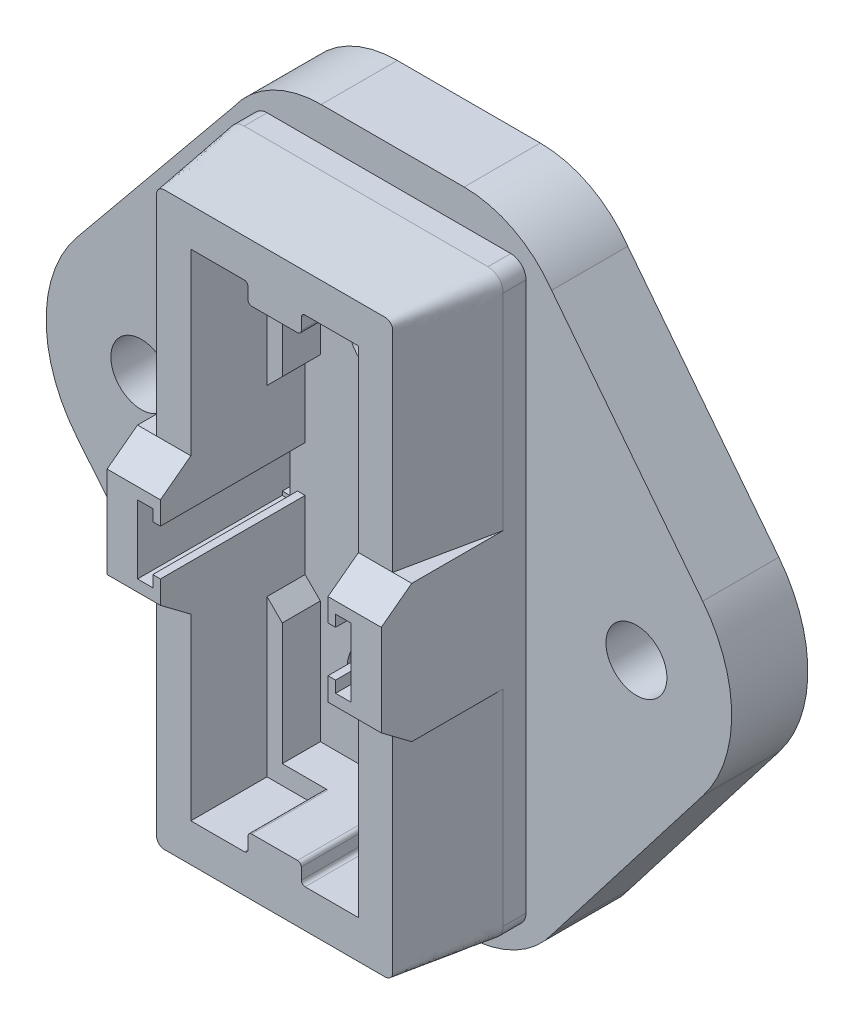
SolidWorks part; units mm, degrees
ref_plane "Plan de face" through (0, 0, 0) normal (0, 0, 1) x (1, 0, 0)
ref_plane "Plan de dessus" through (0, 0, 0) normal (0, 1, 0) x (1, 0, 0)
ref_plane "Plan de droite" through (0, 0, 0) normal (1, 0, 0) x (0, 0, -1)
sketch "Esquisse1" plane through (0, 0, 0) normal (0, 0, 1) x (1, 0, 0)
  line L0 (-68.9124, 0) -> (68.9124, 0) construction
  line L1 (0, 58.4711) -> (0, -58.4711) construction
  line L2 (-8.8895, 42.5) -> (9.8722, 42.5)
  line L3 (21.5728, -36.5) -> (41.2511, -10.9957)
  line L4 (21.3614, 36.5) -> (41.1939, 11.0694)
  line L5 (10.0836, -42.5) -> (-8.8895, -42.5)
  line L6 (-20.3787, -36.5) -> (-40.9272, -11.4032)
  line L7 (-20.3787, 36.5) -> (-40.9272, 11.4032)
  line L8 (45, 0) -> (45, 40.5367) construction
  line L9 (-45, 0) -> (-45, 38.6875) construction
  arc A0 (21.3614, 36.5) -> (9.8722, 42.5) centre (9.8722, 28.5) ccw
  arc A1 (-20.3787, 36.5) -> (-8.8895, 42.5) centre (-8.8895, 28.5) cw
  arc A2 (-8.8895, -42.5) -> (-20.3787, -36.5) centre (-8.8895, -28.5) cw
  arc A3 (21.5728, -36.5) -> (10.0836, -42.5) centre (10.0836, -28.5) cw
  arc A4 (41.2511, -10.9957) -> (41.1939, 11.0694) centre (27, 0) ccw
  arc A5 (-40.9272, 11.4032) -> (-40.9272, -11.4032) centre (-27, 0) ccw
  point P11 (17.4253, 44.5086)
  point P14 (-16.4426, 44.5086)
  point P17 (-16.4426, -45.4914)
  point P20 (17.4253, -45.4914)
  dimension "D2" = 14
  dimension "D3" = 36
  dimension "D4" = 36
  dimension "D1" = 85
  dimension "D5" = 90
  dimension "D8" = 6
  dimension "D9" = 6
extrude "Extrusion1" add sketch "Esquisse1" along normal blind 10
sketch "Esquisse2" plane through (0, 0, 0) normal (0, 0, -1) x (-1, 0, 0)
  line L0 (-59.0836, 0) -> (59.0836, 0) construction
  line L1 (32.5, 38.0939) -> (32.5, 6.9041) construction
  line L2 (-32.5, 38.0939) -> (-32.5, 8.0295) construction
  line L3 (0, 40.9877) -> (0, -9.4946) construction
  circle A0 centre (-32.5, 0) radius 4
  circle A1 centre (32.5, 0) radius 4
  dimension "D3" = 8
  dimension "D4" = 8
  dimension "D1" = 65
  dimension "D2" = 32.5
extrude "Enlèv. mat.-Extru.1" cut sketch "Esquisse2" against normal through all
sketch "Esquisse3" plane through (0, 0, 10) normal (0, 0, 1) x (1, 0, 0)
  line L0 (0, 0) -> (0, 49.1871) construction
  line L1 (-16, 38) -> (16, 38)
  line L2 (-18, 36) -> (-18, -36)
  line L3 (-16, -38) -> (16, -38)
  line L4 (18, 36) -> (18, -36)
  line L5 (0, 0) -> (21.7936, 0) construction
  arc A0 (18, 36) -> (16, 38) centre (16, 36) ccw
  arc A1 (-18, 36) -> (-16, 38) centre (-16, 36) cw
  arc A2 (-16, -38) -> (-18, -36) centre (-16, -36) cw
  arc A3 (16, -38) -> (18, -36) centre (16, -36) ccw
  point P10 (18, 38)
  point P15 (-18, -38)
  point P18 (18, -38)
  dimension "D3" = 2
  dimension "D1" = 76
  dimension "D2" = 36
extrude "Extrusion2" add sketch "Esquisse3" along normal blind 3
ref_plane "Plan1" through (0, 0, 25) normal (0, 0, 1) x (1, 0, 0)
sketch "Esquisse4" plane through (0, 0, 25) normal (0, 0, 1) x (1, 0, 0)
  line L0 (0, 0) -> (62.1473, 0) construction
  line L1 (0, 0) -> (0, 46.9363) construction
  line L3 (-14.5, 37.5) -> (14.5, 37.5)
  line L4 (-15.5, 36.5) -> (-15.5, -36.5)
  line L5 (-14.5, -37.5) -> (14.5, -37.5)
  line L6 (15.5, 36.5) -> (15.5, -36.5)
  arc A0 (-15.5, 36.5) -> (-14.5, 37.5) centre (-14.5, 36.5) cw
  arc A1 (15.5, 36.5) -> (14.5, 37.5) centre (14.5, 36.5) ccw
  arc A2 (14.5, -37.5) -> (15.5, -36.5) centre (14.5, -36.5) ccw
  arc A3 (-15.5, -36.5) -> (-14.5, -37.5) centre (-14.5, -36.5) ccw
  point P12 (15.5, 37.5)
  point P15 (15.5, -37.5)
  point P18 (-15.5, -37.5)
  dimension "D3" = 1
  dimension "D1" = 75
  dimension "D2" = 31
sketch "Esquisse5" plane through (0, 0, 13) normal (0, 0, 1) x (1, 0, 0)
  line L4 (16, 38) -> (-16, 38)
  line L5 (-18, 36) -> (-18, -36)
  line L6 (-16, -38) -> (16, -38)
  line L7 (18, -36) -> (18, 36)
  line L8 (16, 38) -> (-16, 38)
  line L9 (-18, 36) -> (-18, -36)
  line L10 (-16, -38) -> (16, -38)
  line L11 (18, -36) -> (18, 36)
  arc A4 (18, 36) -> (16, 38) centre (16, 36) ccw
  arc A5 (-16, 38) -> (-18, 36) centre (-16, 36) ccw
  arc A6 (-18, -36) -> (-16, -38) centre (-16, -36) ccw
  arc A7 (16, -38) -> (18, -36) centre (16, -36) ccw
  arc A8 (18, 36) -> (16, 38) centre (16, 36) ccw
  arc A9 (-16, 38) -> (-18, 36) centre (-16, 36) ccw
  arc A10 (-18, -36) -> (-16, -38) centre (-16, -36) ccw
  arc A11 (16, -38) -> (18, -36) centre (16, -36) ccw
  dimension "D1" = 0
loft "Lissage1" add profiles "Esquisse5", "Esquisse4"
sketch "Esquisse6" plane through (0, 0, 25) normal (0, 0, 1) x (1, 0, 0)
  line L0 (0, 0) -> (0, 33.1099) construction
  line L1 (0, 0) -> (49.2856, 0) construction
  line L2 (-3.5, 32) -> (-3.5, 30.5)
  line L3 (-11, 32.5) -> (-4, 32.5)
  line L4 (-11, 32.5) -> (-11, -32.5)
  line L5 (-11, -32.5) -> (-4, -32.5)
  line L6 (11, 32.5) -> (11, -32.5)
  line L7 (-3, 30) -> (3, 30)
  line L8 (3.5, 30.5) -> (3.5, 32)
  line L9 (4, 32.5) -> (11, 32.5)
  line L10 (-3.5, -32) -> (-3.5, -30.5)
  line L11 (-3, -30) -> (3, -30)
  line L12 (3.5, -30.5) -> (3.5, -32)
  line L13 (4, -32.5) -> (11, -32.5)
  arc A0 (3.5, 32) -> (4, 32.5) centre (4, 32) cw
  arc A1 (-3.5, 32) -> (-4, 32.5) centre (-4, 32) ccw
  arc A2 (-3, 30) -> (-3.5, 30.5) centre (-3, 30.5) cw
  arc A3 (3.5, 30.5) -> (3, 30) centre (3, 30.5) cw
  arc A4 (3, -30) -> (3.5, -30.5) centre (3, -30.5) cw
  arc A5 (-3.5, -30.5) -> (-3, -30) centre (-3, -30.5) cw
  arc A6 (-4, -32.5) -> (-3.5, -32) centre (-4, -32) ccw
  arc A7 (4, -32.5) -> (3.5, -32) centre (4, -32) cw
  point P18 (3.5, 32.5)
  point P21 (-3.5, 32.5)
  point P24 (-3.5, 30)
  point P27 (3.5, 30)
  point P30 (3.5, -30)
  point P33 (-3.5, -30)
  point P36 (-3.5, -32.5)
  point P39 (3.5, -32.5)
  dimension "D5" = 0.5
  dimension "D1" = 65
  dimension "D2" = 22
  dimension "D3" = 7
  dimension "D4" = 2.5
extrude "Enlèv. mat.-Extru.2" cut sketch "Esquisse6" against normal blind 10
sketch "Esquisse7" plane through (0, 0, 15) normal (0, 0, 1) x (1, 0, 0)
  line L0 (0, 0) -> (0, 47.7402) construction
  line L1 (0, 0) -> (68.5782, 0) construction
  line L2 (3, 30) -> (-3, 30) construction
  line L3 (-9, 30) -> (9, 30)
  line L4 (-9, 30) -> (-9, 12)
  line L5 (-9, -30) -> (9, -30)
  line L6 (9, 30) -> (9, 12)
  line L7 (-3, -30) -> (3, -30) construction
  line L8 (-11, 32.5) -> (-11, -32.5) construction
  line L9 (-11, 12) -> (-9, 12)
  line L10 (-11, 12) -> (-11, -12)
  line L11 (-11, -12) -> (-9, -12)
  line L12 (11, 12) -> (11, -12)
  line L13 (11, -32.5) -> (11, 32.5) construction
  line L14 (9, 12) -> (11, 12)
  line L15 (-9, -12) -> (-9, -30)
  line L16 (9, -12) -> (9, -30)
  line L17 (9, -12) -> (11, -12)
  dimension "D1" = 18
  dimension "D2" = 18
extrude "Enlèv. mat.-Extru.3" cut sketch "Esquisse7" against normal blind 5
sketch "Esquisse8" plane through (0, 0, 25) normal (0, 0, 1) x (1, 0, 0)
  line L0 (0, 0) -> (0, -47.919) construction
  line L1 (0, 0) -> (56.1987, 0) construction
  line L2 (11, -32.5) -> (11, 32.5) construction
  line L3 (11, 9) -> (18, 9)
  line L4 (11, 9) -> (11, 3)
  line L5 (11, -9) -> (18, -9)
  line L6 (18, 9) -> (18, -9)
  line L7 (18, -36) -> (18, 36) construction
  line L8 (11, 3) -> (12, 3)
  line L9 (12, 3) -> (12, 4.5)
  line L10 (12, 4.5) -> (14, 4.5)
  line L11 (14, 4.5) -> (14, -4.5)
  line L12 (14, -4.5) -> (12, -4.5)
  line L13 (12, -4.5) -> (12, -3)
  line L14 (12, -3) -> (11, -3)
  line L15 (11, -3) -> (11, -9)
  line L16 (-11, -3) -> (-11, -9)
  line L17 (-12, -3) -> (-11, -3)
  line L18 (-12, -4.5) -> (-12, -3)
  line L19 (-14, -4.5) -> (-12, -4.5)
  line L20 (-14, 4.5) -> (-14, -4.5)
  line L21 (-12, 4.5) -> (-14, 4.5)
  line L22 (-12, 3) -> (-12, 4.5)
  line L23 (-11, 3) -> (-12, 3)
  line L24 (-18, 9) -> (-18, -9)
  line L25 (-11, -9) -> (-18, -9)
  line L26 (-11, 9) -> (-11, 3)
  line L27 (-11, 9) -> (-18, 9)
  dimension "D1" = 18
  dimension "D2" = 9
  dimension "D3" = 2
  dimension "D4" = 1
  dimension "D5" = 6
extrude "Extrusion3" add sketch "Esquisse8" against normal blind 12
sketch "Esquisse9" plane through (0, 0, 25) normal (0, 0, 1) x (1, 0, 0)
  line L0 (11, -32.5) -> (11, 32.5) construction
  line L1 (0, 0) -> (0, 16.2071) construction
  line L2 (-12, -3) -> (-11, -3)
  line L3 (11, 3) -> (11, -3)
  line L4 (11, 3) -> (12, 3)
  line L5 (12, 3) -> (12, 4.5)
  line L6 (12, 4.5) -> (14, 4.5)
  line L7 (14, 4.5) -> (14, -4.5)
  line L8 (14, -4.5) -> (12, -4.5)
  line L9 (12, -4.5) -> (12, -3)
  line L10 (12, -3) -> (11, -3)
  line L11 (-12, -4.5) -> (-12, -3)
  line L12 (0, 0) -> (66.0886, 0) construction
  line L13 (-14, -4.5) -> (-12, -4.5)
  line L14 (-14, 4.5) -> (-14, -4.5)
  line L15 (-12, 4.5) -> (-14, 4.5)
  line L16 (-12, 3) -> (-12, 4.5)
  line L17 (-11, 3) -> (-12, 3)
  line L18 (-11, 3) -> (-11, -3)
  dimension "D1" = 4.5
  dimension "D2" = 9
  dimension "D3" = 2
  dimension "D4" = 1
  dimension "D5" = 6
  dimension "D6" = 3
extrude "Enlèv. mat.-Extru.4" cut sketch "Esquisse9" against normal up to surface (15 mm away)
sketch "Esquisse10" plane through (0, 0, 10) normal (0, 0, 1) x (1, 0, 0)
  line L0 (0, 0) -> (22.3716, 0) construction
  line L1 (0, 0) -> (0, 14.4758) construction
  line L2 (14, 4.5) -> (14, -4.5) construction
  line L3 (14, 4) -> (13, 4)
  line L4 (14, 4) -> (14, -4)
  line L5 (14, -4) -> (13, -4)
  line L6 (13, 4) -> (13, -4)
  line L7 (-13, 4) -> (-13, -4)
  line L8 (-14, -4) -> (-13, -4)
  line L9 (-14, 4) -> (-14, -4)
  line L10 (-14, 4) -> (-13, 4)
  dimension "D1" = 8
  dimension "D2" = 1
extrude "Enlèv. mat.-Extru.5" cut sketch "Esquisse10" against normal through all
sketch "Esquisse11" plane through (0, 0, 0) normal (0, 0, -1) x (-1, 0, 0)
  line L0 (0, 0) -> (0, 41.6308) construction
  line L1 (0, 0) -> (60.5215, 0) construction
  circle A0 centre (0, 20) radius 12.5
  circle A1 centre (0, -20) radius 12.5
  dimension "D1" = 25
  dimension "D2" = 25
  dimension "D3" = 40
extrude "Extrusion4" add sketch "Esquisse11" along normal blind 10
sketch "Esquisse12" plane through (0, 0, -10) normal (0, 0, -1) x (-1, 0, 0)
  circle A0 centre (0, 20) radius 5
  circle A1 centre (0, -20) radius 5
  circle A2 centre (0, 20) radius 12.5 construction
  circle A3 centre (0, -20) radius 12.5 construction
  dimension "D1" = 10
  dimension "D2" = 10
extrude "Enlèv. mat.-Extru.6" cut sketch "Esquisse12" against normal through all
ref_plane "Plan2" through (0, 0, 29) normal (0, 0, 1) x (1, 0, 0)
sketch "Esquisse13" plane through (0, 0, 29) normal (0, 0, 1) x (1, 0, 0)
  line L0 (18, -9) -> (18, 9) construction
  line L1 (18, -6) -> (18, 6)
  line L2 (11, 3) -> (12, 3) construction
  line L3 (12, -3) -> (11, -3) construction
  line L4 (12, -3) -> (12, -4.5) construction
  line L5 (12, -4.5) -> (14, -4.5) construction
  line L6 (14, -4.5) -> (14, 4.5) construction
  line L7 (12, 4.5) -> (12, 3) construction
  line L8 (12, 4.5) -> (14, 4.5) construction
  line L9 (11, 3) -> (12, 3)
  line L10 (12, -3) -> (11, -3)
  line L11 (12, -3) -> (12, -4.5)
  line L12 (12, -4.5) -> (14, -4.5)
  line L13 (14, -4.5) -> (14, 4.5)
  line L14 (12, 4.5) -> (12, 3)
  line L15 (12, 4.5) -> (14, 4.5)
  line L16 (0, 0) -> (23.65, 0) construction
  line L17 (11, 6) -> (18, 6)
  line L18 (11, 3) -> (11, 32.5) construction
  line L19 (11, -6) -> (18, -6)
  line L20 (11, -12) -> (11, -3) construction
  line L21 (11, 6) -> (11, 3)
  line L22 (11, -6) -> (11, -3)
  line L23 (0, 0) -> (0, 14.3745) construction
  dimension "D1" = 12
sketch "Esquisse14" plane through (0, 0, 25) normal (0, 0, 1) x (1, 0, 0)
  line L0 (18, -9) -> (18, 9) construction
  line L1 (18, -9) -> (18, 9)
  line L2 (11, 3) -> (11, 32.5) construction
  line L3 (11, 3) -> (11, 9)
  line L4 (11, -32.5) -> (11, -3) construction
  line L5 (11, -9) -> (11, -3)
  line L6 (11, -3) -> (12, -3) construction
  line L7 (12, -3) -> (12, -4.5) construction
  line L8 (12, -4.5) -> (14, -4.5) construction
  line L9 (14, -4.5) -> (14, 4.5) construction
  line L10 (14, 4.5) -> (12, 4.5) construction
  line L11 (12, 4.5) -> (12, 3) construction
  line L12 (12, 3) -> (11, 3) construction
  line L13 (11, -3) -> (12, -3)
  line L14 (12, -3) -> (12, -4.5)
  line L15 (12, -4.5) -> (14, -4.5)
  line L16 (14, -4.5) -> (14, 4.5)
  line L17 (14, 4.5) -> (12, 4.5)
  line L18 (12, 4.5) -> (12, 3)
  line L19 (12, 3) -> (11, 3)
  line L20 (18, 9) -> (11, 9)
  line L21 (18, -9) -> (11, -9)
  line L22 (0, 0) -> (0, 12.4077) construction
  line L23 (0, 0) -> (0, 14.3745) construction
loft "Lissage2" add profiles "Esquisse14", "Esquisse13"
mirror "Symétrie1" about plane through (0, 0, 0) normal (1, 0, 0) of "Lissage2"
chamfer "Chanfrein1" distance 1 angle 45 2 edges at (-12.5, -20, -10) (-12.5, 20, -10)
chamfer "Chanfrein2" distance 2 angle 45 4 edges at (-9, 12, 12.5) (-9, -12, 12.5) (9, 12, 12.5) (9, -12, 12.5)
sketch "Esquisse15" plane through (0, 0, 0) normal (0, 0, -1) x (-1, 0, 0)
  line L0 (0, 0) -> (0, 48.3832) construction
  line L1 (0, 0) -> (55.8591, 0) construction
  line L8 (37.0585, 8.2356) -> (16.3731, 33.4997)
  line L9 (-17.3263, 33.5436) -> (-37.2512, 7.9946)
  line L10 (8.8895, 37.5) -> (-9.8722, 37.5)
  line L11 (35.9886, 9.5424) -> (16.6246, 33.1924)
  line L13 (15.9792, 33.5506) -> (8.5742, 34.5086)
  line L14 (13.2124, 10.5587) -> (27.8796, 5.2203)
  arc A0 (8.0383, 32.6644) -> (8.5742, 34.5086) centre (8.5742, 33.5086) cw
  arc A1 (16.6246, 33.1924) -> (15.9792, 33.5506) centre (15.8509, 32.5589) ccw
  arc A2 (13.2124, 10.5587) -> (12.7073, 12.0298) centre (13.5544, 11.4984) cw
  arc A3 (27.8796, 5.2203) -> (28.7921, 5.3387) centre (28.2216, 6.16) ccw
  circle A7 centre (32.5, 0) radius 4 construction
  arc A8 (33.9844, 6.3282) -> (28.7921, 5.3387) centre (32.5, 0) ccw
  circle A9 centre (0, 20) radius 12.5 construction
  arc A10 (33.9844, 6.3282) -> (35.9886, 9.5424) centre (34.4411, 8.2754) ccw
  arc A16 (12.7073, 12.0298) -> (8.0383, 32.6644) centre (0, 20) ccw
  arc A20 (37.0585, -8.2356) -> (37.0585, 8.2356) centre (27, 0) ccw
  arc A21 (16.3731, 33.4997) -> (8.8895, 37.5) centre (8.8895, 28.5) ccw
  arc A22 (-37.2512, 7.9946) -> (-37.2925, -7.9414) centre (-27, 0) ccw
  arc A23 (-9.8722, 37.5) -> (-17.3263, 33.5436) centre (-9.8722, 28.5) ccw
  point P23 (12, 11)
  dimension "D1" = 15
  dimension "D2" = 13
  dimension "D3" = 4
  dimension "D7" = 12
  dimension "D8" = 1
  dimension "D5" = 1
  dimension "D6" = 20
  dimension "D4" = 5
ref_plane "Plan3" through (0, 0, 5) normal (0, 0, -1) x (-1, 0, 0)
extrude "Enlèv. mat.-Extru.7" cut sketch "Esquisse15" against normal blind 5
mirror "Symétrie3" about plane through (0, 0, 0) normal (1, 0, 0) of "Enlèv. mat.-Extru.7"
mirror "Symétrie4" about plane through (0, 0, 0) normal (0, 1, 0) of "Enlèv. mat.-Extru.7", "Symétrie3"
chamfer "Chanfrein3" distance 0.5 angle 45 2 edges at (5, 20, 10) (5, -20, 10)
draft "Dépouille1" type of draft neutral plane draft angle 4 faces to draft 9 parameters "D1"=4
draft "Dépouille2" type of draft neutral plane draft angle 4 faces to draft 10 parameters "D1"=4
draft "Dépouille3" type of draft neutral plane draft angle 4 faces to draft 10 parameters "D1"=4
draft "Dépouille4" type of draft neutral plane draft angle 4 faces to draft 10 parameters "D1"=4
